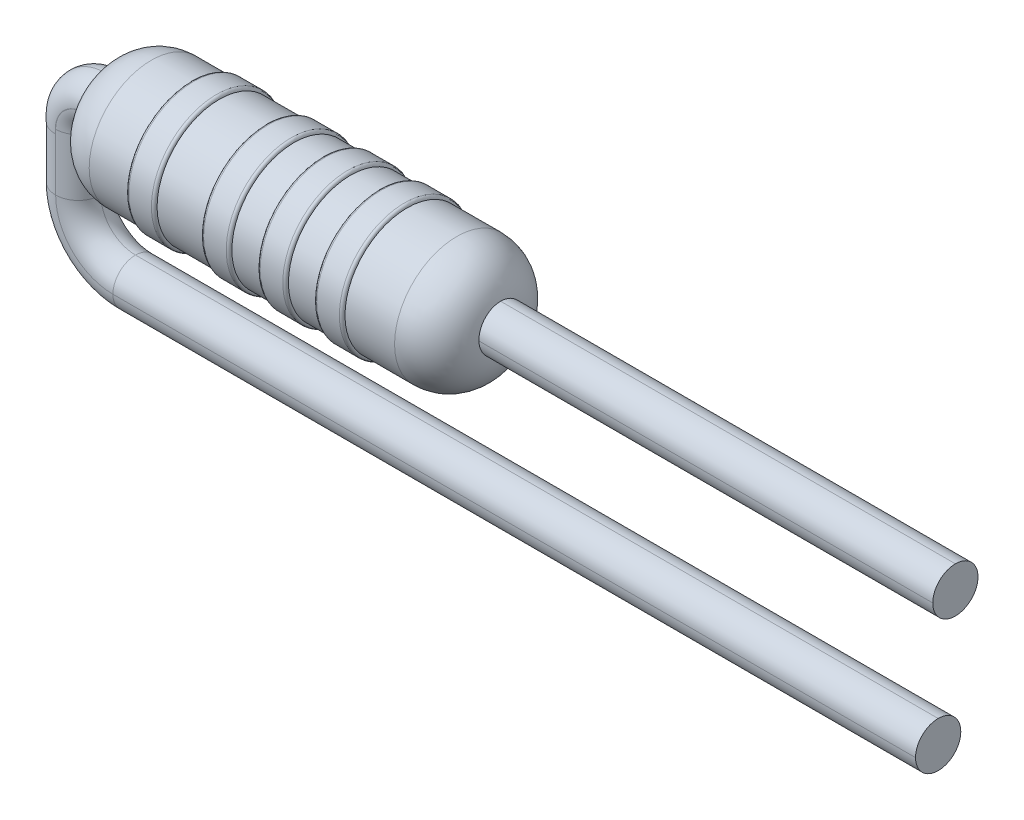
SolidWorks part; units mm, degrees
ref_plane "Face" through (0, 0, 0) normal (0, 0, 1) x (1, 0, 0)
ref_plane "Dessus" through (0, 0, 0) normal (0, 1, 0) x (1, 0, 0)
ref_plane "Droite" through (0, 0, 0) normal (1, 0, 0) x (0, 0, -1)
sketch "Esquisse1" plane through (0, 0, 0) normal (0, 0, 1) x (1, 0, 0)
  line L0 (-54.2687, 0) -> (62.1733, 0) construction
  line L1 (-48.4922, 1.1) -> (45.7559, 1.1) construction
  line L2 (-3.5, -1.6411) -> (-3.5, 4.3175) construction
  line L3 (0, -1.0268) -> (0, 4.1947) construction
  line L4 (3.5, 3.6009) -> (3.5, -1.9687) construction
  line L5 (-3.5, 0) -> (-3.5, 0.3)
  line L6 (-2.7, 1.1) -> (2.7, 1.1)
  line L7 (3.5, 0.3) -> (3.5, 0)
  line L8 (3.5, 0) -> (-3.5, 0)
  arc A0 (-2.7, 1.1) -> (-3.5, 0.3) centre (-2.7, 0.3) ccw
  arc A1 (3.5, 0.3) -> (2.7, 1.1) centre (2.7, 0.3) ccw
revolve "Base-Révolution" add sketch "Esquisse1" angle 360 about L0
sketch "Esquisse2" plane through (0, 0, 0) normal (0, 0, 1) x (1, 0, 0)
  line L0 (-3.3896, 1.15) -> (3.161, 1.15) construction
  line L1 (-2, 1.3889) -> (-2, -0.1179) construction
  line L2 (-1.5, 1.4925) -> (-1.5, -0.2136) construction
  line L3 (4.3262, 0) -> (-3.8651, 0) construction
  line L4 (1.323, 0) -> (1.823, 0)
  line L5 (0.323, 0) -> (0.823, 0)
  line L6 (-0.677, 1.15) -> (-0.677, 0)
  line L7 (0.323, 1.15) -> (0.323, 0)
  line L8 (1.323, 1.15) -> (1.323, 0)
  line L9 (-0.177, 1.15) -> (-0.177, 0)
  line L10 (0.823, 1.15) -> (0.823, 0)
  line L11 (1.823, 1.15) -> (1.823, 0)
  line L12 (-0.677, 0) -> (-0.177, 0)
  line L13 (-0.677, 1.15) -> (-0.177, 1.15)
  line L14 (0.323, 1.15) -> (0.823, 1.15)
  line L15 (1.323, 1.15) -> (1.823, 1.15)
  line L16 (-2, 1.15) -> (-1.5, 1.15)
  line L17 (-1.5, 1.15) -> (-1.5, 0)
  line L18 (-1.5, 0) -> (-2, 0)
  line L19 (-2, 0) -> (-2, 1.15)
revolve "Boss.-Révol.1" add sketch "Esquisse2" angle 360 about L3
fillet "Congé1" radius 0.05 8 edges at (-0.177, 0, -1.15) (-0.677, 0, -1.15) (0.823, 0, -1.15) (0.323, 0, -1.15) (1.823, 0, -1.15) (1.323, 0, -1.15) (-1.5, 0, -1.15) (-2, 0, -1.15)
sketch "Esquisse4" plane through (0, 0, 0) normal (0, 0, 1) x (1, 0, 0)
  line L0 (-5.2315, 0) -> (12.7504, 0) construction
  line L1 (-3.9883, 1.8916) -> (-3.9883, -12.2251) construction
  line L2 (4.25, 2.0093) -> (4.25, -12.4289) construction
  line L3 (-5.7433, -2.4696) -> (23.4577, -2.4696) construction
  line L4 (11.517, 0.4955) -> (11.517, -0.3045)
  line L5 (11.2127, -2.0253) -> (11.2127, -2.8253)
  line L6 (-4.8666, -1.4128) -> (-2.9809, -1.4128) construction
  line L7 (-2.9809, -2.8253) -> (11.2127, -2.8253)
  line L8 (-4.3934, -0.4999) -> (-4.3934, -1.4128)
  line L9 (11.517, 0.4955) -> (-3.5888, 0.4955)
  line L10 (-2.9809, -2.0253) -> (11.2127, -2.0253)
  line L11 (-3.5934, -0.4045) -> (-3.5934, -1.4128)
  line L12 (11.517, -0.3045) -> (-3.4934, -0.3045)
  line L13 (-2.9809, -1.4128) -> (-2.9809, -3.2519) construction
  arc A0 (-3.5934, -1.4128) -> (-2.9809, -2.0253) centre (-2.9809, -1.4128) ccw
  arc A1 (-4.3934, -1.4128) -> (-2.9809, -2.8253) centre (-2.9809, -1.4128) ccw
  arc A3 (-4.3934, -0.4999) -> (-3.5888, 0.4955) centre (-3.4934, -0.4045) cw
  arc A5 (-3.5934, -0.4045) -> (-3.4934, -0.3045) centre (-3.4934, -0.4045) cw
  dimension "D1" = 0.8
  dimension "D3" = 0.8
extrude "Boss.-Extru.2" add sketch "Esquisse4" along normal mid plane 0.8
fillet "Congé8" radius 0.4 51 edges at (-1.9346, -0.352, -0.4) (-1.9321, 0.4955, -0.1714) (-3.4999, -0.3047, -0.0658) (-1.9346, -0.352, 0.4) (-3.5934, -0.4045, 0) (-3.5641, -0.3338, -0.4) (1.9021, -0.3045, -0.1872) (7.4955, -0.3045, -0.4) (-3.4934, -0.3045, 0.3318) (-3.4836, -0.3045, -0.4) (-3.4934, -0.3045, -0.3318) (7.4713, 0.4955, -0.4) (1.9321, 0.4955, 0.1714) (11.517, 0.4955, 0) (-3.5072, 0.4955, -0.4) (7.4955, -0.3045, 0.4) (11.517, 0.0955, 0.4) (7.4713, 0.4955, 0.4) (-3.5072, 0.4955, 0.4) (-4.1972, 0.1644, 0.4) (-4.3934, -0.9564, 0.4) (-3.9797, -2.4116, 0.4) (4.1159, -2.8253, 0.4) (11.2127, -2.4253, 0.4) (4.1159, -2.0253, 0.4) (-3.414, -1.8459, 0.4) (-3.5934, -0.9087, 0.4) (-3.5641, -0.3338, 0.4) (-3.4836, -0.3045, 0.4) (1.9302, -0.3287, -0.4) (-3.414, -1.8459, -0.4) (-2.9809, -2.0253, 0) (-3.5934, -0.9087, -0.4) (-3.5934, -1.4128, 0) (11.517, 0.0955, -0.4) (11.517, -0.3045, 0) (-4.1972, 0.1644, -0.4) (-3.5888, 0.4955, 0) (-4.3934, -0.9564, -0.4) (-4.3934, -0.4999, 0) (-3.9797, -2.4116, -0.4) (-4.3934, -1.4128, 0) (4.1159, -2.8253, -0.4) (-2.9809, -2.8253, 0) (11.2127, -2.4253, -0.4) (11.2127, -2.8253, 0) (4.1159, -2.0253, -0.4) (11.2127, -2.0253, 0) (1.9302, -0.3287, 0.4)
